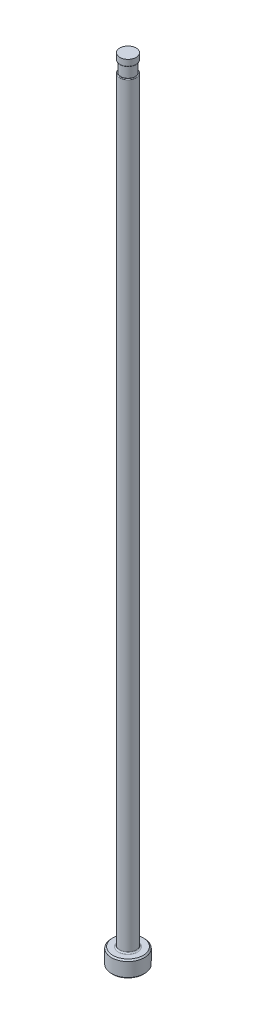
SolidWorks part; units mm, degrees
ref_plane "Front Plane" through (0, 0, 0) normal (0, 0, 1) x (1, 0, 0)
ref_plane "Top Plane" through (0, 0, 0) normal (0, 1, 0) x (1, 0, 0)
ref_plane "Right Plane" through (0, 0, 0) normal (1, 0, 0) x (0, 0, -1)
other "Configuration Table"
sketch "Sketch1" plane through (0, 0, 0) normal (0, 0, 1) x (1, 0, 0)
  line L0 (0, 259.9588) -> (0, -15.1925) construction
  line L1 (0, 0) -> (-3.175, 0)
  line L2 (-3.175, 0) -> (-3.175, 3.175)
  line L3 (-3.175, 3.175) -> (-1.5875, 3.175)
  line L4 (-1.5875, 3.175) -> (-1.5875, 152.4)
  line L5 (-1.5875, 152.4) -> (0, 152.4)
  line L6 (0, 152.4) -> (0, 0)
  dimension "L" = 152.4
  dimension "H" = 6.35
  dimension "T" = 3.175
  dimension "D" = 3.175
revolve "Revolve1" add sketch "Sketch1" angle 360 about L0
chamfer "Chamfer1" distance 0.254 angle 45 2 edges at (0, 3.175, 3.175) (0, 0, 3.175)
fillet "Fillet1" radius 0.254 1 edges at (0, 3.175, 1.5875)
sketch "Sketch2" plane through (0, 0, 0) normal (0, 0, 1) x (1, 0, 0)
  line L0 (-1.5875, 152.4) -> (-1.5875, 3.429) construction
  line L1 (-1.5875, 151.13) -> (-1.3843, 151.13)
  line L2 (-1.5875, 151.13) -> (-1.5875, 149.098)
  line L3 (-1.5875, 149.098) -> (-1.3843, 149.098)
  line L4 (-1.3843, 151.13) -> (-1.3843, 149.098)
  line L5 (1.5875, 152.4) -> (-1.5875, 152.4) construction
  line L6 (0, 153.4483) -> (0, 147.3282) construction
  dimension "D1" = 2.032
  dimension "N" = 1.27
  dimension "FD" = 0.2032
  dimension "D3" = 2.7686
revolve "Vent Relief" cut sketch "Sketch2" angle 360 about L6
sketch "Sketch3" plane through (0, 0, 0) normal (0, 0, 1) x (1, 0, 0)
  line L0 (-1.3843, 150.114) -> (-1.3843, 86.614)
  line L1 (-1.3843, 151.13) -> (-1.3843, 149.098) construction
  line L2 (-1.5875, 149.098) -> (-1.5875, 3.429) construction
  line L3 (-1.5875, 85.4964) -> (-1.5875, 150.114)
  line L4 (-1.5875, 150.114) -> (-1.3843, 150.114)
  arc A0 (-1.3843, 86.614) -> (-1.5875, 85.4964) centre (-4.5593, 86.614) cw
  dimension "D1" = 3.175
  dimension "D2" = 63.5
extrude "D-Slot" cut sketch "Sketch3" against normal through all both and the other way through all
sketch "Sketch5" plane through (0, 0, 0) normal (0, 0, 1) x (1, 0, 0)
  line L0 (-1.5875, 151.13) -> (1.5875, 151.13) construction
  line L1 (-1.5875, 152.4) -> (-1.5748, 152.4)
  line L2 (-1.5875, 152.4) -> (-1.5875, 151.13)
  line L3 (-1.5875, 151.13) -> (-1.5748, 151.13)
  line L4 (-1.5748, 152.4) -> (-1.5748, 151.13)
  line L5 (0, 152.6877) -> (0, 150.5771) construction
  dimension "VP" = 0.0127
revolve "Vent Diameter" cut sketch "Sketch5" angle 360 about L5
fillet "Fillet2" radius 0.127 2 edges at (1.5875, 149.098, 0) (0, 151.13, 1.5748)
sketch "Pocket Sketch" plane through (0, 0, 0) normal (0, 0, 1) x (1, 0, 0)
  line L0 (-3.5719, 0) -> (-3.5719, 3.2004)
  line L1 (-3.5719, 3.2004) -> (-2.5479, 3.2004)
  line L2 (-1.7859, 3.9624) -> (-1.7859, 22.225)
  line L3 (-1.7859, 22.225) -> (0, 22.225)
  line L4 (0, 22.225) -> (0, 0)
  line L5 (0, 0) -> (-3.5719, 0)
  line L6 (0, 12.6104) -> (0, -2.4989) construction
  line L7 (-3.175, 2.921) -> (-3.175, 0.254) construction
  line L8 (2.921, 3.175) -> (-2.921, 3.175) construction
  line L9 (-1.5875, 85.4964) -> (-1.5875, 3.429) construction
  line L10 (-2.5479, 3.2004) -> (-1.7859, 3.9624)
  point P3 (-1.7859, 3.2004)
  dimension "D1" = 7.1437
  dimension "D2" = 0.3969
  dimension "D3" = 0.0254
  dimension "D4" = 0.1984
  dimension "D5" = 3.5719
  dimension "D6" = 22.225
